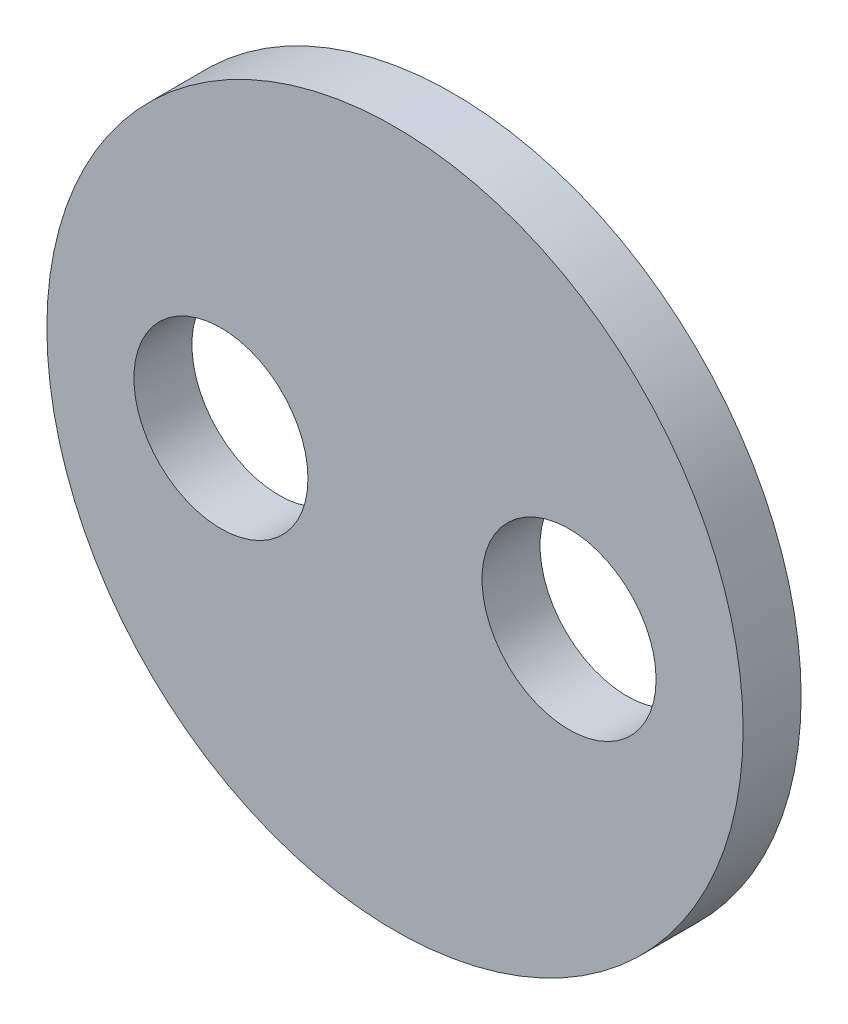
SolidWorks part; units mm, degrees
ref_plane "前视基准面" through (0, 0, 0) normal (0, 0, 1) x (1, 0, 0)
ref_plane "上视基准面" through (0, 0, 0) normal (0, 1, 0) x (1, 0, 0)
ref_plane "右视基准面" through (0, 0, 0) normal (1, 0, 0) x (0, 0, -1)
other "Configuration Table"
sketch "草图1" plane through (0, 0, 0) normal (0, 0, 1) x (1, 0, 0)
  circle A0 centre (0, 0) radius 6
extrude "凸台-拉伸1" add sketch "草图1" along normal blind 1 contours A0
sketch "草图2" plane through (0, 0, 1) normal (0, 0, 1) x (1, 0, 0)
  circle A0 centre (-3, 0) radius 1.5
  circle A1 centre (3, 0) radius 1.5
  point P4 (0, 0)
  dimension "D1" = 3
  dimension "D2" = 3
extrude "切除-拉伸1" cut sketch "草图2" against normal blind 2
